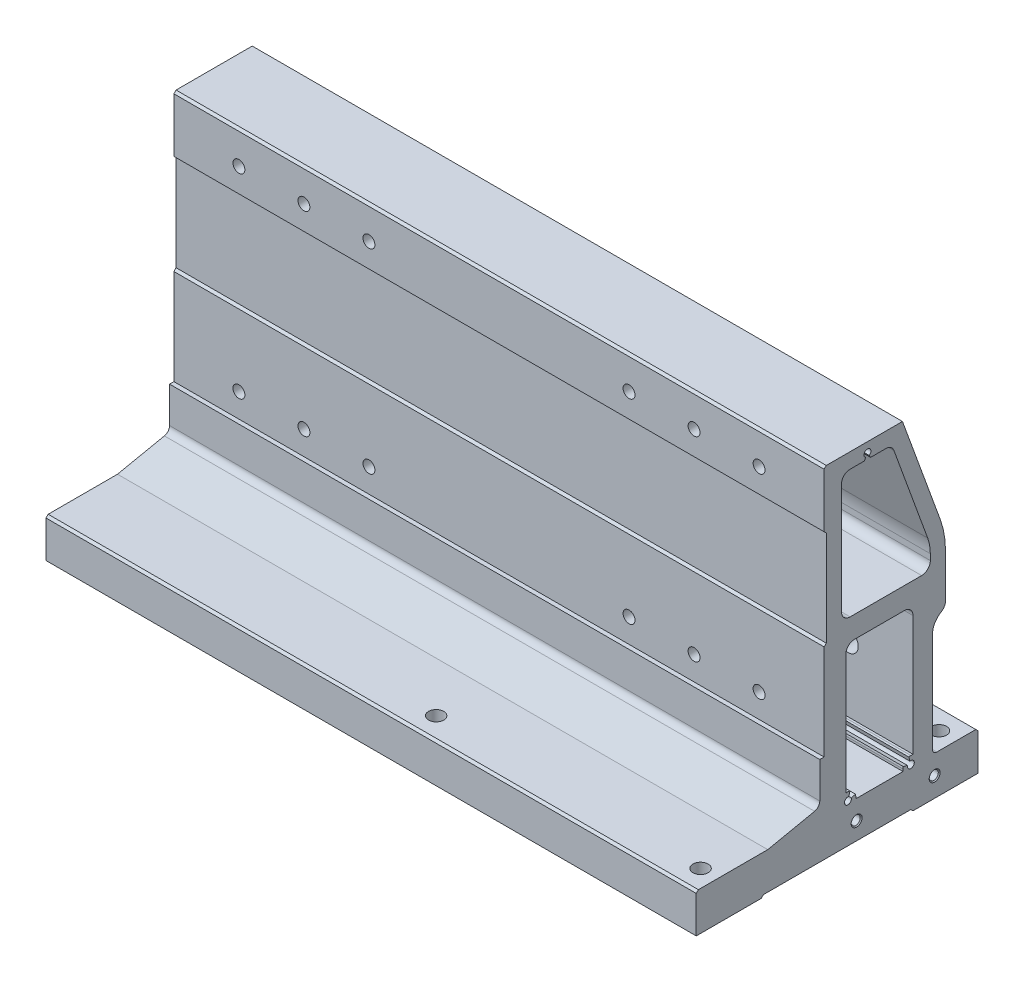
SolidWorks part; units mm, degrees
ref_plane "정면" through (0, 0, 0) normal (0, 0, 1) x (1, 0, 0)
ref_plane "윗면" through (0, 0, 0) normal (0, 1, 0) x (1, 0, 0)
ref_plane "우측면" through (0, 0, 0) normal (1, 0, 0) x (0, 0, -1)
sketch "스케치1" plane through (0, 0, 0) normal (1, 0, 0) x (0, 0, -1)
  line L0 (-5, 157) -> (-6, 156)
  line L1 (-6, 156) -> (-6, 131)
  line L2 (-6, 131) -> (-5, 130)
  line L3 (-5, 130) -> (-5, 86)
  line L4 (-5, 86) -> (-6, 85)
  line L5 (-6, 85) -> (-6, 40.9998)
  line L6 (-6, 40.9998) -> (-8, 40.9998)
  line L7 (-8, 40.9998) -> (-8, 24.4394)
  line L8 (-10.3881, 21.5025) -> (-32, 17)
  line L9 (-32, 17) -> (-64, 17)
  line L10 (-64, 17) -> (-65, 16)
  line L11 (-65, 16) -> (-65, -1)
  line L12 (-65, -1) -> (-35, -1)
  line L13 (-35, -1) -> (-34, 0)
  line L14 (-34, 0) -> (34, 0)
  line L15 (34, 0) -> (35, -1)
  line L16 (35, -1) -> (65, -1)
  line L17 (65, -1) -> (65, 16)
  line L18 (65, 16) -> (64, 17)
  line L19 (64, 17) -> (46, 17)
  line L20 (44, 19) -> (44, 65)
  line L21 (50, 75.3923) -> (50, 95.442)
  line L22 (47.5845, 109.1317) -> (30.149, 157)
  line L23 (30.149, 157) -> (-5, 157)
  line L24 (2, 95) -> (2, 146)
  line L25 (6, 150) -> (12.5566, 150)
  line L26 (12.5566, 150) -> (13.2, 151.1144)
  line L27 (14.8, 151.1144) -> (15.4434, 150)
  line L28 (15.4434, 150) -> (22.4487, 150)
  line L29 (26.2071, 147.369) -> (41.7922, 104.5807)
  line L30 (43, 97.7359) -> (43, 95)
  line L31 (39, 91) -> (6, 91)
  line L32 (8, 81) -> (31, 81)
  line L33 (35, 77) -> (35, 21.6)
  line L34 (35, 21.6) -> (34, 21.6)
  line L35 (33.0683, 21.4773) -> (33.5859, 19.5455)
  line L36 (32.4545, 18.4141) -> (30.5227, 18.9317)
  line L37 (30.4, 18) -> (30.4, 17)
  line L38 (30.4, 17) -> (8.6, 17)
  line L39 (8.6, 17) -> (8.6, 18)
  line L40 (8.4773, 18.9317) -> (6.5455, 18.4141)
  line L41 (5.4141, 19.5455) -> (5.9317, 21.4773)
  line L42 (5, 21.6) -> (4, 21.6)
  line L43 (4, 21.6) -> (4, 77)
  arc A0 (-10.3881, 21.5025) -> (-8, 24.4394) centre (-11, 24.4394) ccw
  arc A1 (44, 19) -> (46, 17) centre (46, 19) ccw
  arc A2 (48, 71.9282) -> (44, 65) centre (52, 65) ccw
  arc A3 (48, 71.9282) -> (50, 75.3923) centre (46, 75.3923) ccw
  arc A4 (50, 95.442) -> (47.5845, 109.1317) centre (10, 95.442) ccw
  arc A5 (6, 150) -> (2, 146) centre (6, 146) ccw
  arc A6 (14.8, 151.1144) -> (13.2, 151.1144) centre (14, 152.5) ccw
  arc A7 (26.2071, 147.369) -> (22.4487, 150) centre (22.4487, 146) ccw
  arc A8 (43, 97.7359) -> (41.7922, 104.5807) centre (23, 97.7359) ccw
  arc A9 (39, 91) -> (43, 95) centre (39, 95) ccw
  arc A10 (2, 95) -> (6, 91) centre (6, 95) ccw
  arc A11 (8, 81) -> (4, 77) centre (8, 77) ccw
  arc A12 (35, 77) -> (31, 81) centre (31, 77) ccw
  arc A13 (34, 21.6) -> (33.0683, 21.4773) centre (34, 18) ccw
  arc A14 (32.4545, 18.4141) -> (33.5859, 19.5455) centre (34, 18) ccw
  arc A15 (30.5227, 18.9317) -> (30.4, 18) centre (34, 18) ccw
  arc A16 (8.6, 18) -> (8.4773, 18.9317) centre (5, 18) ccw
  arc A17 (5.4141, 19.5455) -> (6.5455, 18.4141) centre (5, 18) ccw
  arc A18 (5.9317, 21.4773) -> (5, 21.6) centre (5, 18) ccw
extrude "보스-돌출1" add sketch "스케치1" along normal mid plane 300
hole_wizard "M5 소켓 머리 캡 나사용 카운터보어1" positions "스케치2" profile "스케치3" counterbore size "M5" standard "KS"
sketch "스케치2" plane through (0, 0, -50) normal (0, 0, -1) x (-1, 0, 0)
  line L0 (-150, -1) -> (150, -1) construction
  line L1 (-150, 109.1317) -> (-150, 157) construction
  point P0 (-120, 142)
  point P2 (-90, 142)
  point P4 (-60, 142)
  point P6 (-120, 52)
  point P8 (-90, 52)
  point P10 (-60, 52)
  dimension "D1" = 90
  dimension "D2" = 53
  dimension "D3" = 30
  dimension "D4" = 30
  dimension "D5" = 30
sketch "스케치3" plane through (120, 142, -50) normal (1, 0, 0) x (0, 1, 0)
  line L0 (0, 0) -> (0, 115)
  line L1 (0, 115) -> (2.75, 115)
  line L3 (2.75, 115) -> (2.75, 49)
  line L4 (2.75, 49) -> (4.75, 49)
  line L5 (4.75, 49) -> (4.75, 0)
  line L7 (4.75, 0) -> (0, 0)
  line L11 (0, -6.35) -> (0, 107.95) construction
  dimension "관통 구멍 지름" = 5.5
  dimension "관통 구멍 깊이" = 115
  dimension "카운터보어 지름" = 9.5
  dimension "카운터보어 깊이" = 49
pattern_linear "선형 패턴1" count 2 spacing 180 along (-1, 0, 0) of "M5 소켓 머리 캡 나사용 카운터보어1"
hole_wizard "M5 나사 구멍1" positions "스케치4" profile "스케치5" tap size "M5" standard "ISO"
sketch "스케치4" plane through (150, 0, 0) normal (1, 0, 0) x (0, 0, -1)
  line L0 (65, -1) -> (65, 16) construction
  line L1 (35, -1) -> (65, -1) construction
  point P0 (45, 8)
  point P2 (9, 8)
  dimension "D1" = 36
  dimension "D2" = 20
  dimension "D3" = 9
sketch "스케치5" plane through (150, 8, -45) normal (0, 1, 0) x (0, 0, -1)
  line L0 (0, 0) -> (0, 13.2618)
  line L1 (0, 13.2618) -> (2.1, 12)
  line L2 (2.1, 12) -> (2.1, 0.425)
  line L3 (2.1, 0.425) -> (2.525, 0)
  line L5 (2.525, 0) -> (0, 0)
  line L6 (-2.1, 0.425) -> (-2.525, 0) construction
  line L10 (0, 13.2618) -> (-2.1, 12) construction
  line L11 (0, -6.35) -> (0, 107.95) construction
  dimension "탭 드릴 지름" = 4.2
  dimension "탭 드릴 깊이" = 12
  dimension "표면 카운터싱크 지름" = 5.05
  dimension "표면 카운터싱크 각도" = 90
  dimension "드릴 각도" = 118
hole_wizard "Ø5.0mm 맞춤핀 구멍1" positions "스케치6" profile "스케치7" hole size "Ø5.0" standard "ISO"
sketch "스케치6" plane through (0, 0, 0) normal (0, -1, 0) x (-1, 0, 0)
  line L0 (0, 0) -> (-180.923, 0) construction
  line L1 (-150, -34) -> (-150, 34) construction
  point P6 (-142, 0)
  point P8 (-20, 0)
  dimension "D1" = 122
  dimension "D2" = 8
sketch "스케치7" plane through (20, 0, 0) normal (1, 0, 0) x (0, 0, -1)
  line L0 (0, 0) -> (0, 11.5022)
  line L1 (0, 11.5022) -> (2.5, 10)
  line L2 (2.5, 10) -> (2.5, 0)
  line L5 (2.5, 0) -> (0, 0)
  line L10 (0, 11.5022) -> (-2.5, 10) construction
  line L11 (0, -6.35) -> (0, 107.95) construction
  dimension "구멍 지름" = 5
  dimension "구멍 깊이" = 10
  dimension "드릴 각도" = 118
hole_wizard "Ø7.0 (7) 지름 구멍1" positions "스케치8" profile "스케치9" hole size "Ø7.0" standard "ISO"
sketch "스케치8" plane through (0, -1, 0) normal (0, -1, 0) x (-1, 0, 0)
  line L0 (-150, 65) -> (150, 65) construction
  line L1 (-150, -65) -> (-150, -35) construction
  point P0 (-142, -55)
  point P2 (-20, -55)
  point P4 (-20, 55)
  point P6 (-142, 55)
  dimension "D1" = 110
  dimension "D2" = 10
  dimension "D3" = 8
  dimension "D4" = 122
sketch "스케치9" plane through (142, -1, 55) normal (1, 0, 0) x (0, 0, -1)
  line L0 (0, 0) -> (0, 158)
  line L1 (0, 158) -> (3.5, 158)
  line L2 (3.5, 158) -> (3.5, 0)
  line L5 (3.5, 0) -> (0, 0)
  line L11 (0, -6.35) -> (0, 107.95) construction
  dimension "관통 구멍 지름" = 7
  dimension "관통 구멍 깊이" = 158
